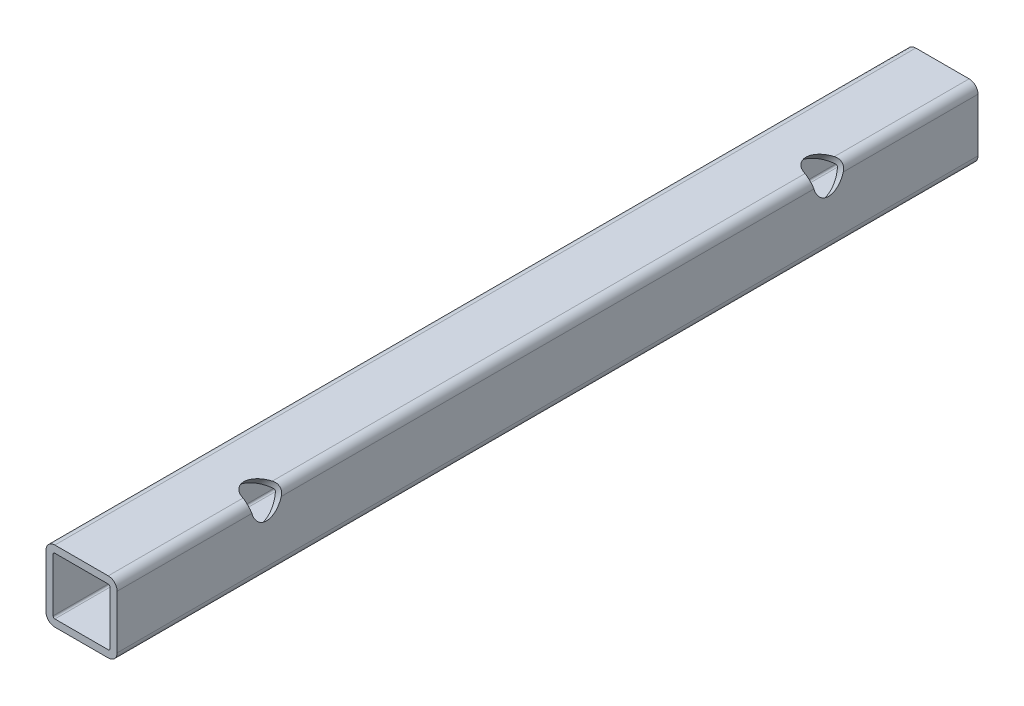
SolidWorks part; units mm, degrees
ref_plane "Plan de face" through (0, 0, 0) normal (0, 0, 1) x (1, 0, 0)
ref_plane "Plan de dessus" through (0, 0, 0) normal (0, 1, 0) x (1, 0, 0)
ref_plane "Plan de droite" through (0, 0, 0) normal (1, 0, 0) x (0, 0, -1)
sketch "Esquisse2" plane through (0, 0, 0) normal (0, 0, 1) x (1, 0, 0)
  line L1 (-7.5, 10) -> (7.5, 10)
  line L2 (-10, 7.5) -> (-10, -7.5)
  line L3 (-7.5, -10) -> (7.5, -10)
  line L4 (10, 7.5) -> (10, -7.5)
  line L5 (-10, 7.5) -> (-10, 10) construction
  line L6 (-10, 10) -> (-7.5, 10) construction
  line L7 (-7.5, 8) -> (7.5, 8)
  line L8 (8, 7.5) -> (8, -7.5)
  line L9 (-7.5, -8) -> (7.5, -8)
  line L10 (-8, 7.5) -> (-8, -7.5)
  line L11 (-7.5, -7.5) -> (7.5, 7.5) construction
  arc A0 (-10, -7.5) -> (-7.5, -10) centre (-7.5, -7.5) ccw
  arc A1 (7.5, -10) -> (10, -7.5) centre (7.5, -7.5) ccw
  arc A2 (7.5, 10) -> (10, 7.5) centre (7.5, 7.5) cw
  arc A3 (-7.5, 10) -> (-10, 7.5) centre (-7.5, 7.5) ccw
  arc A4 (7.5, 8) -> (8, 7.5) centre (7.5, 7.5) cw
  arc A5 (7.5, -8) -> (8, -7.5) centre (7.5, -7.5) ccw
  arc A6 (-8, -7.5) -> (-7.5, -8) centre (-7.5, -7.5) ccw
  arc A7 (-7.5, 8) -> (-8, 7.5) centre (-7.5, 7.5) ccw
  point P4 (0, 0)
  point P14 (-10, 10)
  dimension "D1" = 2.5
  dimension "D2" = 20
  dimension "D3" = 20
  dimension "D4" = 2
extrude "Boss.-Extru.1" add sketch "Esquisse2" along normal mid plane 242
ref_plane "Plan1" through (9.2678, 9.2678, 0) normal (0.7071, 0.7071, 0) x (0, 0, -1)
sketch "Esquisse3" plane through (9.2678, 9.2678, 0) normal (0.7071, 0.7071, 0) x (0, 0, -1)
  line L1 (0, 35.0328) -> (0, -46.1875) construction
  circle A0 centre (-79, 0) radius 4.5
  circle A1 centre (79, 0) radius 4.5
  dimension "D1" = 9
  dimension "D2" = 158
extrude "Enlèv. mat.-Extru.1" cut sketch "Esquisse3" against normal up to next
